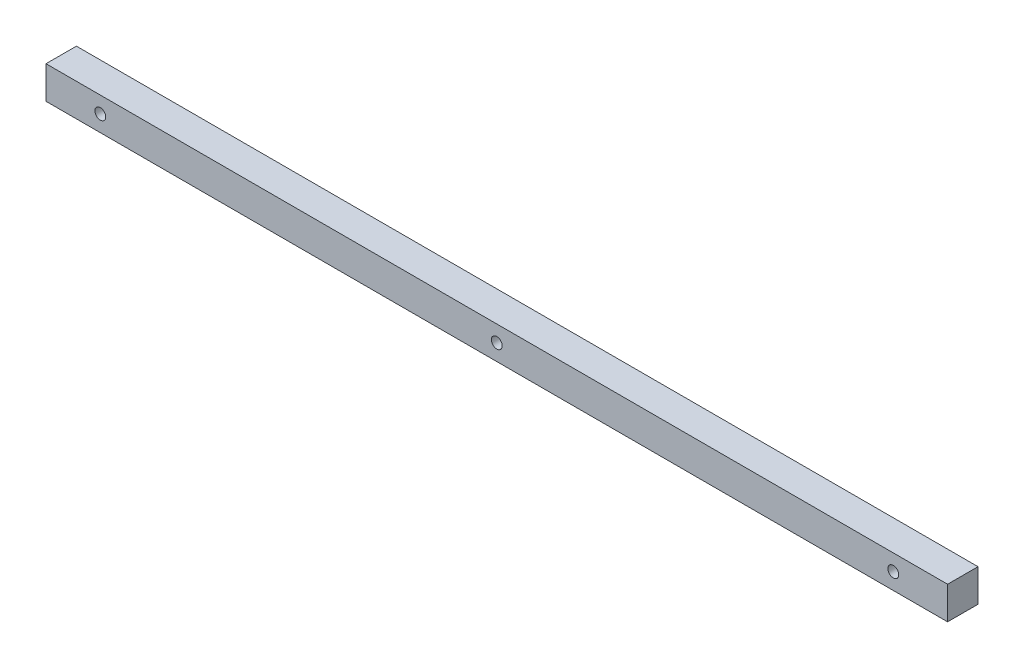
SolidWorks part; units mm, degrees
ref_plane "Спереди" through (0, 0, 0) normal (0, 0, 1) x (1, 0, 0)
ref_plane "Сверху" through (0, 0, 0) normal (0, 1, 0) x (1, 0, 0)
ref_plane "Справа" through (0, 0, 0) normal (1, 0, 0) x (0, 0, -1)
sketch "Эскиз1" plane through (0, 0, 0) normal (0, 0, 1) x (1, 0, 0)
  line L0 (-365, 0) -> (0, 0) construction
  line L1 (-415, 15) -> (415, 15)
  line L2 (-415, 15) -> (-415, -15)
  line L3 (-415, -15) -> (415, -15)
  line L4 (415, 15) -> (415, -15)
  line L5 (0, -15) -> (0, 15) construction
  line L11 (0, 0) -> (365, 0) construction
  circle A1 centre (-365, 0) radius 5
  circle A2 centre (0, 0) radius 5
  circle A3 centre (365, 0) radius 5
  dimension "D3" = 10
  dimension "D4" = 50
  dimension "D5" = 50
  dimension "D1" = 30
  dimension "D2" = 830
extrude "Бобышка-Вытянуть1" add sketch "Эскиз1" along normal blind 28
